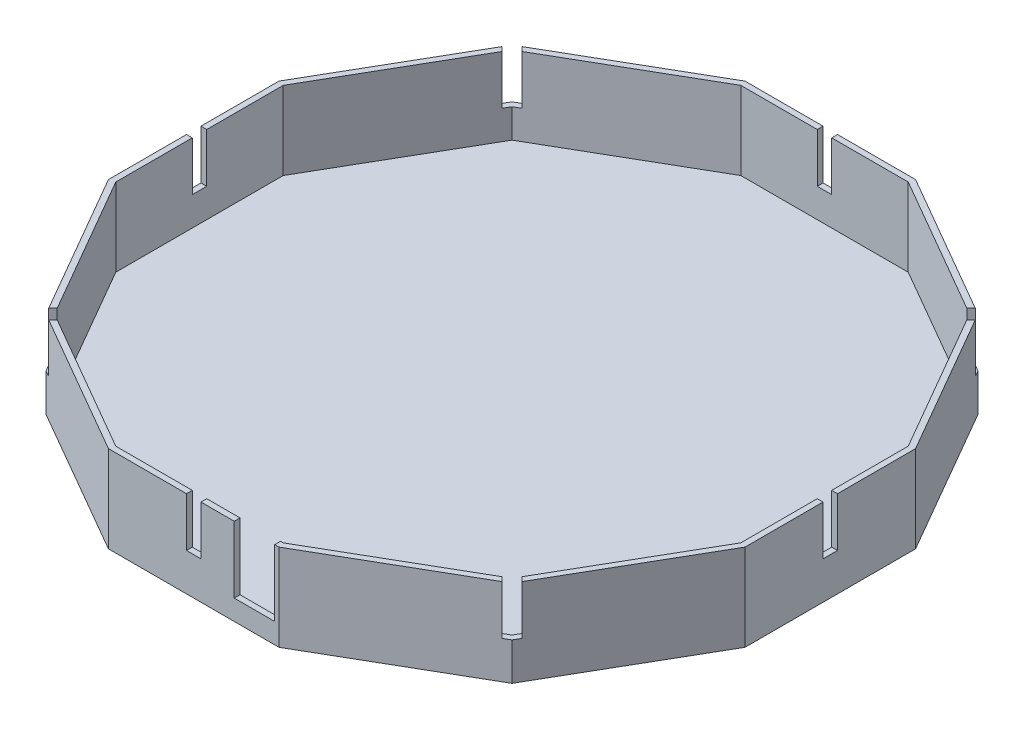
SolidWorks part; units mm, degrees
ref_plane "Front Plane" through (0, 0, 0) normal (0, 0, 1) x (1, 0, 0)
ref_plane "Top Plane" through (0, 0, 0) normal (0, 1, 0) x (1, 0, 0)
ref_plane "Right Plane" through (0, 0, 0) normal (1, 0, 0) x (0, 0, -1)
sketch "Sketch5" plane through (0, 0, 0) normal (0, 1, 0) x (1, 0, 0)
  line L1 (109, 29.2065) -> (79.7935, 79.7935) construction
  line L2 (79.7935, 79.7935) -> (29.2065, 109) construction
  line L3 (29.2065, 109) -> (-29.2065, 109) construction
  line L4 (-29.2065, 109) -> (-79.7935, 79.7935) construction
  line L5 (-79.7935, 79.7935) -> (-109, 29.2065) construction
  line L6 (-109, 29.2065) -> (-109, -29.2065) construction
  line L7 (-109, -29.2065) -> (-79.7935, -79.7935) construction
  line L8 (-79.7935, -79.7935) -> (-29.2065, -109) construction
  line L9 (-29.2065, -109) -> (29.2065, -109) construction
  line L10 (29.2065, -109) -> (79.7935, -79.7935) construction
  line L11 (79.7935, -79.7935) -> (109, -29.2065) construction
  line L12 (109, -29.2065) -> (109, 29.2065) construction
  line L13 (110, 29.4744) -> (80.5256, 80.5256)
  line L14 (80.5256, 80.5256) -> (29.4744, 110)
  line L16 (-29.4744, 110) -> (-80.5256, 80.5256)
  line L17 (-80.5256, 80.5256) -> (-110, 29.4744)
  line L19 (-110, -29.4744) -> (-80.5256, -80.5256)
  line L20 (-80.5256, -80.5256) -> (-29.4744, -110)
  line L22 (29.4744, -110) -> (80.5256, -80.5256)
  line L23 (80.5256, -80.5256) -> (110, -29.4744)
  line L24 (108, -28.9385) -> (108, 28.9385)
  line L25 (108, 28.9385) -> (79.0615, 79.0615)
  line L26 (79.0615, 79.0615) -> (28.9385, 108)
  line L27 (28.9385, 108) -> (-28.9385, 108)
  line L28 (-28.9385, 108) -> (-79.0615, 79.0615)
  line L29 (-79.0615, 79.0615) -> (-108, 28.9385)
  line L30 (-108, 28.9385) -> (-108, -28.9385)
  line L31 (-108, -28.9385) -> (-79.0615, -79.0615)
  line L32 (-79.0615, -79.0615) -> (-28.9385, -108)
  line L33 (-28.9385, -108) -> (28.9385, -108)
  line L34 (28.9385, -108) -> (79.0615, -79.0615)
  line L35 (79.0615, -79.0615) -> (108, -28.9385)
  line L36 (110, 29.4744) -> (110, -29.4744)
  line L37 (-29.4744, 110) -> (29.4744, 110)
  line L46 (110, -29.4744) -> (110, 29.4744) construction
  line L50 (29.4744, 110) -> (-29.4744, 110) construction
  line L51 (-110, 29.4744) -> (-110, -29.4744) construction
  line L52 (-29.4744, -110) -> (29.4744, -110) construction
  line L55 (-110, 29.4744) -> (-110, -29.4744)
  line L57 (-29.4744, -110) -> (29.4744, -110)
  circle A0 centre (0, 0) radius 109 construction
  point P1 (109, 0)
  point P16 (94.3968, 54.5)
  point P77 (0, 0)
  dimension "D1" = 108
  dimension "D2" = 1
  dimension "D3" = 1
extrude "Walls of Enclosure" add sketch "Sketch5" along normal blind 30
sketch "Sketch7" plane through (0, 0, 0) normal (0, 1, 0) x (1, 0, 0)
  line L47 (108, -28.9385) -> (108, 28.9385)
  line L48 (79.0615, -79.0615) -> (108, -28.9385)
  line L49 (28.9385, -108) -> (79.0615, -79.0615)
  line L50 (-28.9385, -108) -> (28.9385, -108)
  line L51 (-79.0615, -79.0615) -> (-28.9385, -108)
  line L52 (-108, -28.9385) -> (-79.0615, -79.0615)
  line L53 (-108, 28.9385) -> (-108, -28.9385)
  line L54 (-79.0615, 79.0615) -> (-108, 28.9385)
  line L55 (-28.9385, 108) -> (-79.0615, 79.0615)
  line L56 (28.9385, 108) -> (-28.9385, 108)
  line L57 (79.0615, 79.0615) -> (28.9385, 108)
  line L58 (108, 28.9385) -> (79.0615, 79.0615)
  line L59 (108, -28.9385) -> (108, 28.9385)
  line L60 (79.0615, -79.0615) -> (108, -28.9385)
  line L61 (28.9385, -108) -> (79.0615, -79.0615)
  line L62 (-28.9385, -108) -> (28.9385, -108)
  line L63 (-79.0615, -79.0615) -> (-28.9385, -108)
  line L64 (-108, -28.9385) -> (-79.0615, -79.0615)
  line L65 (-108, 28.9385) -> (-108, -28.9385)
  line L66 (-79.0615, 79.0615) -> (-108, 28.9385)
  line L67 (-28.9385, 108) -> (-79.0615, 79.0615)
  line L68 (28.9385, 108) -> (-28.9385, 108)
  line L69 (79.0615, 79.0615) -> (28.9385, 108)
  line L70 (108, 28.9385) -> (79.0615, 79.0615)
  dimension "D1" = 0
extrude "Bottom of Enclosure" add sketch "Sketch7" along normal blind 3
sketch "Sketch8" plane through (0, 30, 0) normal (0, 1, 0) x (1, 0, 0)
  line L0 (0, 0) -> (124.8901, 0) construction
  line L2 (92.8659, -2.5) -> (122.8659, -2.5)
  line L3 (92.8659, -2.5) -> (92.8659, 2.5)
  line L4 (92.8659, 2.5) -> (122.8659, 2.5)
  line L5 (122.8659, -2.5) -> (122.8659, 2.5)
  line L6 (92.8659, -2.5) -> (122.8659, 2.5) construction
  line L7 (92.8659, 2.5) -> (122.8659, -2.5) construction
  point P3 (107.8659, 0)
  point P8 (0, 0)
  point P9 (0, 0)
  dimension "D1" = 5
  dimension "D2" = 30
  dimension "D3" = 107.8659
extrude "Wire Slot" cut sketch "Sketch8" against normal blind 17
sketch "Reference Sketch" plane through (0, 0, 0) normal (0, 1, 0) x (1, 0, 0)
  circle A0 centre (0, 0) radius 43.3294
  dimension "D1" = 86.6588
pattern_curve "Other Wire Slots" of "Wire Slot" parameters "D1"=8, "D3"=50, "D2"=1, "D4"=50
sketch "Sketch10" plane through (0, 30, 0) normal (0, 1, 0) x (1, 0, 0)
  line L0 (0, 0) -> (0, -161.3092) construction
  line L2 (14, -115) -> (28, -115)
  line L3 (14, -115) -> (14, -105)
  line L4 (14, -105) -> (28, -105)
  line L5 (28, -115) -> (28, -105)
  line L6 (14, -115) -> (28, -105) construction
  line L7 (14, -105) -> (28, -115) construction
  point P3 (21, -110)
  point P8 (16.9532, -109.1748)
  dimension "D1" = 14
  dimension "D2" = 10
  dimension "D3" = 14
  dimension "D4" = 110
extrude "MicroUSB Slot" cut sketch "Sketch10" against normal blind 23
